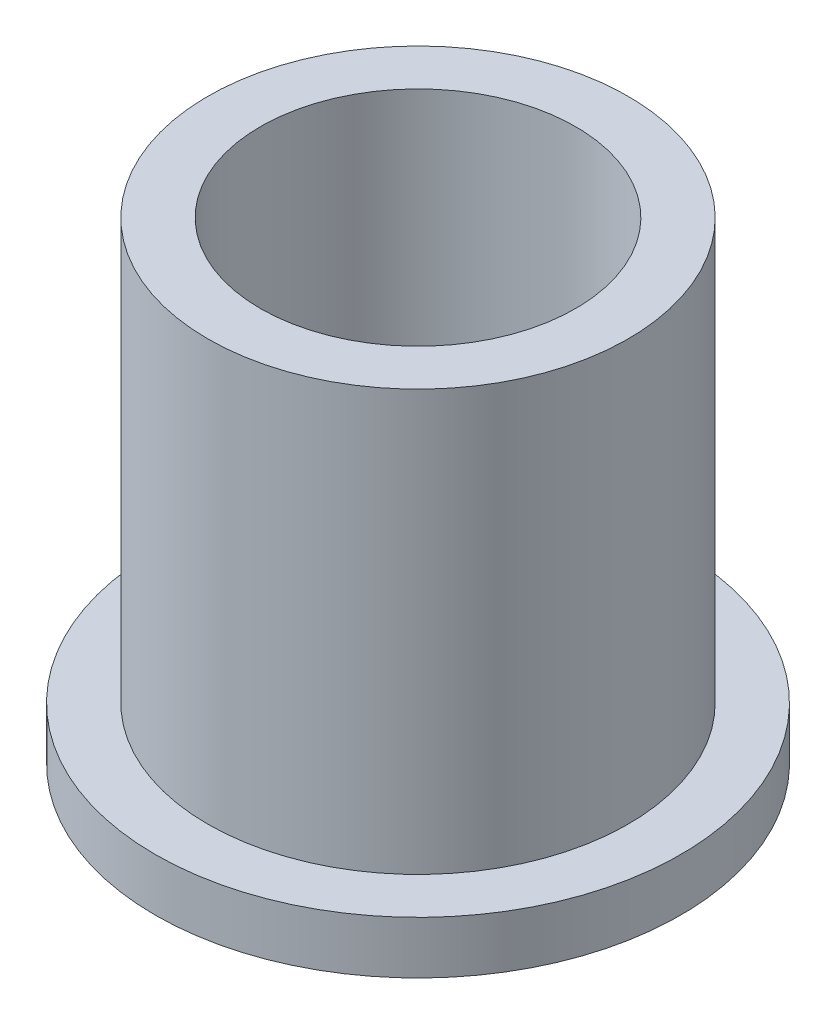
SolidWorks part; units mm, degrees
ref_plane "Front Plane" through (0, 0, 0) normal (0, 0, 1) x (1, 0, 0)
ref_plane "Top Plane" through (0, 0, 0) normal (0, 1, 0) x (1, 0, 0)
ref_plane "Right Plane" through (0, 0, 0) normal (1, 0, 0) x (0, 0, -1)
sketch "Sketch1" plane through (0, 0, 0) normal (0, 1, 0) x (1, 0, 0)
  circle A0 centre (0, 0) radius 4.7625
  circle A1 centre (0, 0) radius 6.35
  dimension "D1" = 9.525
  dimension "D2" = 12.7
extrude "Boss-Extrude1" add sketch "Sketch1" along normal blind 12.7
sketch "Sketch2" plane through (0, 0, 0) normal (0, -1, 0) x (1, 0, 0)
  circle A0 centre (0, 0) radius 7.9375
  circle A3 centre (0, 0) radius 4.7625 construction
  circle A4 centre (0, 0) radius 4.7625
  dimension "D1" = 15.875
extrude "Boss-Extrude2" add sketch "Sketch2" along normal blind 1.5875 separate body
